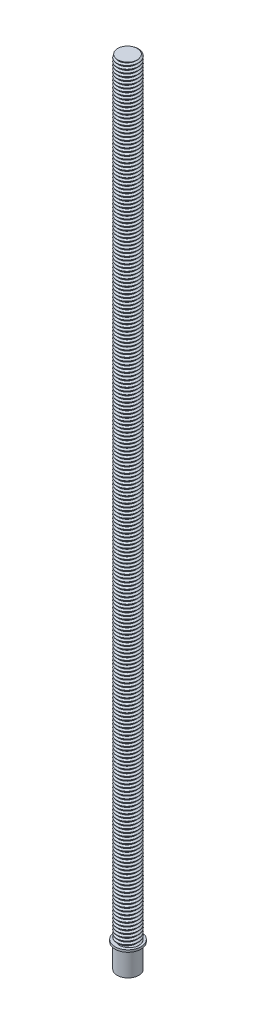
SolidWorks part; units mm, degrees
ref_plane "Front Plane" through (0, 0, 0) normal (0, 0, 1) x (1, 0, 0)
ref_plane "Top Plane" through (0, 0, 0) normal (0, 1, 0) x (1, 0, 0)
ref_plane "Right Plane" through (0, 0, 0) normal (1, 0, 0) x (0, 0, -1)
sketch "Sketch1" plane through (0, 0, 0) normal (0, 1, 0) x (1, 0, 0)
  circle A0 centre (0, 0) radius 5
  dimension "D1" = 10
extrude "Boss-Extrude1" add sketch "Sketch1" along normal blind 355.6
thread "Thread1" pitch 1.5 start angle 0, offset 1.5, length 361.95, pitch 1.5, diameter 10
ref_plane "Plane1" through (-5, 357.1, 0) normal (0, 0, 1) x (-1, 0, 0)
sketch "Thread Profile1" plane through (-5, 357.1, 0) normal (0, 0, 1) x (-1, 0, 0)
  line L0 (0, 0) -> (0, 1.5) construction
  line L11 (0, 0) -> (0, 1.3125)
  line L12 (0, 1.3125) -> (-0.8119, 0.8437)
  line L13 (-0.8119, 0.8437) -> (-0.8119, 0.4687)
  line L15 (-0.8119, 0.4687) -> (0, 0)
  line L17 (-0.8119, 0.6562) -> (0, 0.6562) construction
  point P2 (0, 0)
  dimension "Pitch" = 1.5
  dimension "Profile_Angle" = 60
  dimension "Profile_Land" = 0.375
  dimension "Profile_Height" = 0.8119
sketch "Sketch6" plane through (0, 0, 0) normal (0, -1, 0) x (1, 0, 0)
  circle A0 centre (0, 0) radius 5
  dimension "D1" = 10
extrude "Boss-Extrude2" add sketch "Sketch6" along normal blind 11
sketch "Sketch8" plane through (0, 0, 0) normal (0, 1, 0) x (1, 0, 0)
  circle A0 centre (0, 0) radius 6
  dimension "D1" = 12
extrude "Boss-Extrude3" add sketch "Sketch8" along normal blind 1
